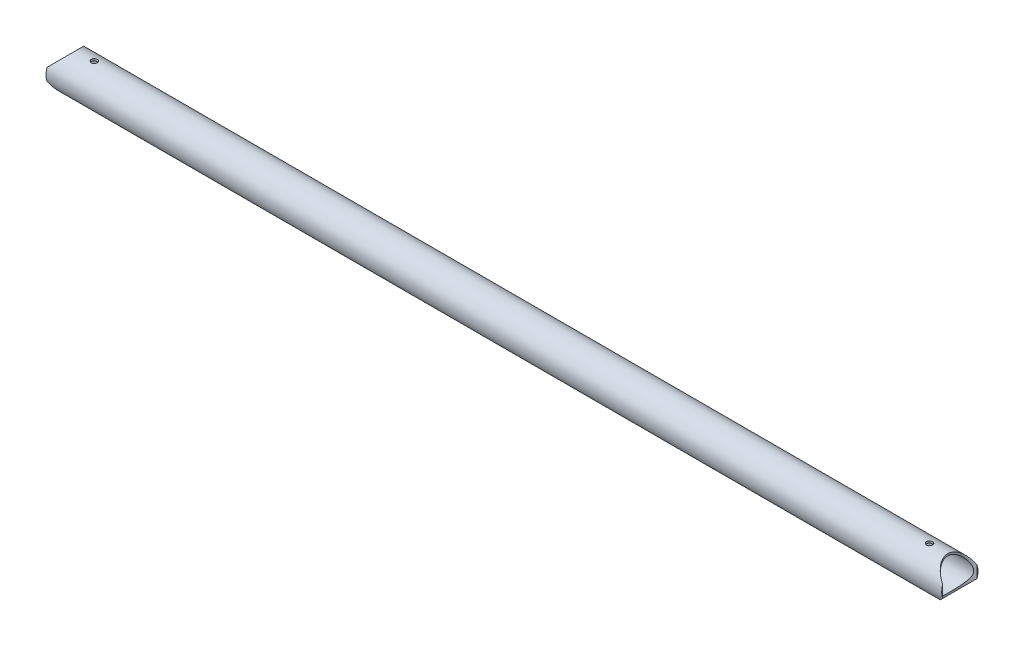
SolidWorks part; units mm, degrees
ref_plane "Front Plane" through (0, 0, 0) normal (0, 0, 1) x (1, 0, 0)
ref_plane "Top Plane" through (0, 0, 0) normal (0, 1, 0) x (1, 0, 0)
ref_plane "Right Plane" through (0, 0, 0) normal (1, 0, 0) x (0, 0, -1)
sketch "Sketch1" plane through (0, 0, 0) normal (1, 0, 0) x (0, 0, -1)
  circle A0 centre (0, 0) radius 19.05
  circle A1 centre (0, 0) radius 16.9418
  dimension "D1" = 38.1
  dimension "D2" = 2.1082
extrude "Extrude1" add sketch "Sketch1" along normal mid plane 939.8
sketch "Sketch2" plane through (0, 0, 0) normal (0, 1, 0) x (1, 0, 0)
  line L0 (-590.4005, 0) -> (20.9734, 0) construction
  line L1 (-469.9, 19.05) -> (-469.9, -19.05) construction
  circle A0 centre (-476.25, 0) radius 19.05
  circle A1 centre (-438.15, 0) radius 3.175
  dimension "D1" = 476.25
  dimension "D2" = 38.1
  dimension "D3" = 6.35
  dimension "D4" = 31.75
extrude "Extrude2" cut sketch "Sketch2" against normal through all and the other way through all
mirror "Mirror1" about plane through (0, 0, 0) normal (1, 0, 0) of "Extrude2"
